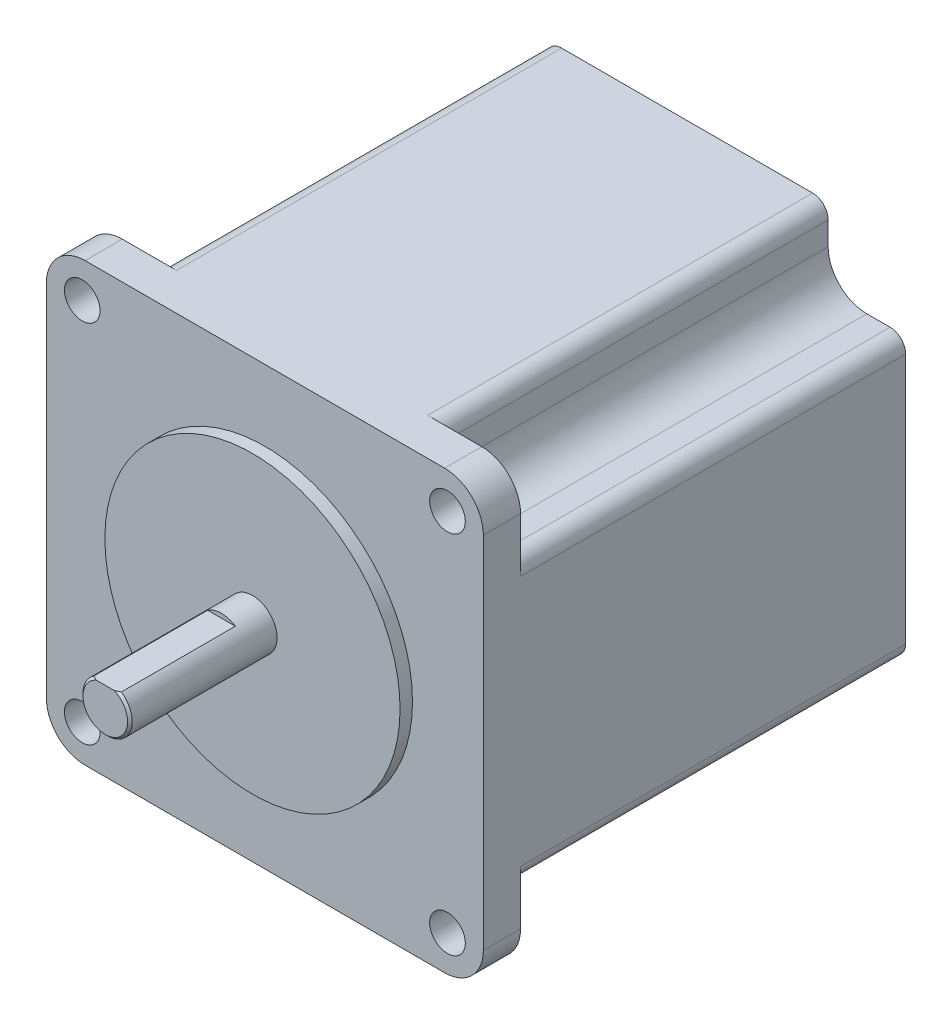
SolidWorks part; units mm, degrees
ref_plane "前视基准面" through (0, 0, 0) normal (0, 0, 1) x (1, 0, 0)
ref_plane "上视基准面" through (0, 0, 0) normal (0, 1, 0) x (1, 0, 0)
ref_plane "右视基准面" through (0, 0, 0) normal (1, 0, 0) x (0, 0, -1)
sketch "草图1" plane through (0, 0, 0) normal (0, 0, 1) x (1, 0, 0)
  circle A0 centre (0, 0) radius 19.05
extrude "凸台-拉伸1" add sketch "草图1" against normal blind 1.6
sketch "草图2" plane through (0, 0, 0) normal (0, 0, 1) x (1, 0, 0)
  circle A0 centre (0, 0) radius 3.175
extrude "凸台-拉伸2" add sketch "草图2" along normal blind 19
sketch "草图3" plane through (0, 0, 19) normal (0, 0, 1) x (1, 0, 0)
  line L1 (0, 2.625) -> (4.1544, 2.625)
  line L2 (4.1544, 2.625) -> (4.1544, 5.02)
  line L3 (4.1544, 5.02) -> (-4.5996, 5.02)
  line L4 (-4.5996, 5.02) -> (-4.5996, 2.625)
  line L5 (-4.5996, 2.625) -> (0, 2.625)
extrude "切除-拉伸1" cut sketch "草图3" against normal blind 15
sketch "草图4" plane through (0, 0, -1.6) normal (0, 0, -1) x (-1, 0, 0)
  line L1 (0, 28.2) -> (23.2, 28.2)
  line L2 (28.2, 23.2) -> (28.2, -23.2)
  line L3 (23.2, -28.2) -> (-23.2, -28.2)
  line L4 (-28.2, -23.2) -> (-28.2, 23.2)
  line L5 (-23.2, 28.2) -> (0, 28.2)
  arc A0 (-23.2, -28.2) -> (-28.2, -23.2) centre (-23.2, -23.2) cw
  arc A1 (28.2, -23.2) -> (23.2, -28.2) centre (23.2, -23.2) cw
  arc A2 (23.2, 28.2) -> (28.2, 23.2) centre (23.2, 23.2) cw
  arc A3 (-28.2, 23.2) -> (-23.2, 28.2) centre (-23.2, 23.2) cw
  dimension "D1" = 5
extrude "凸台-拉伸3" add sketch "草图4" along normal blind 54.5
sketch "草图5" plane through (0, 0, -56.1) normal (0, 0, -1) x (-1, 0, 0)
  line L1 (23.2, 28.2) -> (-23.2, 28.2) construction
  line L2 (11.4944, 28.2) -> (16.2, 28.2)
  line L3 (18.2, 26.2) -> (18.2, 23.2)
  line L4 (23.2, 18.2) -> (26.2, 18.2)
  line L5 (28.2, -23.2) -> (28.2, 23.2) construction
  line L6 (28.2, 16.2) -> (28.2, 9.9204)
  line L7 (28.2, 9.9204) -> (36.4601, 9.9204)
  line L8 (36.4601, 9.9204) -> (36.4601, 32.1771)
  line L9 (36.4601, 32.1771) -> (11.4944, 32.1771)
  line L10 (11.4944, 32.1771) -> (11.4944, 28.2)
  line L12 (-11.4944, 32.1771) -> (-11.4944, 28.2)
  line L13 (-36.4601, 32.1771) -> (-11.4944, 32.1771)
  line L14 (-36.4601, 9.9204) -> (-36.4601, 32.1771)
  line L15 (-28.2, 9.9204) -> (-36.4601, 9.9204)
  line L16 (-28.2, 16.2) -> (-28.2, 9.9204)
  line L17 (-23.2, 18.2) -> (-26.2, 18.2)
  line L18 (-18.2, 26.2) -> (-18.2, 23.2)
  line L19 (-11.4944, 28.2) -> (-16.2, 28.2)
  line L20 (11.4944, -32.1771) -> (11.4944, -28.2)
  line L21 (36.4601, -32.1771) -> (11.4944, -32.1771)
  line L22 (36.4601, -9.9204) -> (36.4601, -32.1771)
  line L23 (28.2, -9.9204) -> (36.4601, -9.9204)
  line L24 (28.2, -16.2) -> (28.2, -9.9204)
  line L25 (23.2, -18.2) -> (26.2, -18.2)
  line L26 (18.2, -26.2) -> (18.2, -23.2)
  line L27 (11.4944, -28.2) -> (16.2, -28.2)
  line L28 (-11.4944, -28.2) -> (-16.2, -28.2)
  line L29 (-18.2, -26.2) -> (-18.2, -23.2)
  line L30 (-23.2, -18.2) -> (-26.2, -18.2)
  line L31 (-28.2, -16.2) -> (-28.2, -9.9204)
  line L32 (-28.2, -9.9204) -> (-36.4601, -9.9204)
  line L33 (-36.4601, -9.9204) -> (-36.4601, -32.1771)
  line L34 (-36.4601, -32.1771) -> (-11.4944, -32.1771)
  line L35 (-11.4944, -32.1771) -> (-11.4944, -28.2)
  arc A0 (18.2, 23.2) -> (23.2, 18.2) centre (23.2, 23.2) ccw
  arc A1 (26.2, 18.2) -> (28.2, 16.2) centre (26.2, 16.2) cw
  arc A2 (16.2, 28.2) -> (18.2, 26.2) centre (16.2, 26.2) cw
  arc A3 (-16.2, 28.2) -> (-18.2, 26.2) centre (-16.2, 26.2) ccw
  arc A4 (-26.2, 18.2) -> (-28.2, 16.2) centre (-26.2, 16.2) ccw
  arc A5 (-18.2, 23.2) -> (-23.2, 18.2) centre (-23.2, 23.2) cw
  arc A6 (16.2, -28.2) -> (18.2, -26.2) centre (16.2, -26.2) ccw
  arc A7 (26.2, -18.2) -> (28.2, -16.2) centre (26.2, -16.2) ccw
  arc A8 (18.2, -23.2) -> (23.2, -18.2) centre (23.2, -23.2) cw
  arc A9 (-18.2, -23.2) -> (-23.2, -18.2) centre (-23.2, -23.2) ccw
  arc A10 (-26.2, -18.2) -> (-28.2, -16.2) centre (-26.2, -16.2) cw
  arc A11 (-16.2, -28.2) -> (-18.2, -26.2) centre (-16.2, -26.2) cw
  point P20 (28.2, 18.2)
  point P23 (18.2, 28.2)
  point P38 (-18.2, 28.2)
  point P39 (-28.2, 18.2)
  point P54 (18.2, -28.2)
  point P55 (28.2, -18.2)
  point P70 (-28.2, -18.2)
  point P71 (-18.2, -28.2)
  dimension "D1" = 5
  dimension "D2" = 2
extrude "切除-拉伸2" cut sketch "草图5" against normal blind 49.7
sketch "草图6" plane through (0, 0, -1.6) normal (0, 0, 1) x (1, 0, 0)
  circle A0 centre (-23.57, 23.57) radius 2.3
  circle A1 centre (23.57, 23.57) radius 2.3
  circle A2 centre (23.57, -23.57) radius 2.3
  circle A3 centre (-23.57, -23.57) radius 2.3
extrude "切除-拉伸3" cut sketch "草图6" against normal blind 49.7
chamfer "倒角1" distance 0.3 angle 45 1 edges at (0, -3.175, 19)
